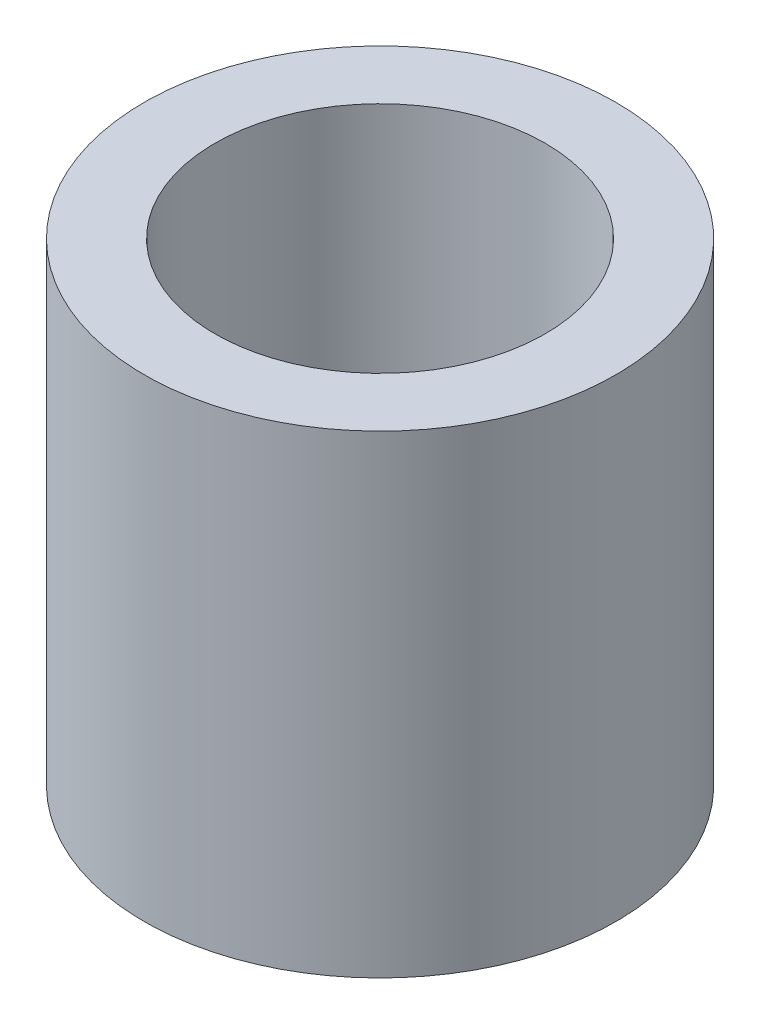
SolidWorks part; units mm, degrees
ref_plane "Plan de face" through (0, 0, 0) normal (0, 0, 1) x (1, 0, 0)
ref_plane "Plan de dessus" through (0, 0, 0) normal (0, 1, 0) x (1, 0, 0)
ref_plane "Plan de droite" through (0, 0, 0) normal (1, 0, 0) x (0, 0, -1)
sketch "Esquisse1" plane through (0, 0, 0) normal (0, 0, 1) x (1, 0, 0)
  line L0 (0, 0) -> (0, 62.8412) construction
  line L1 (20, 0) -> (0, 0) construction
  line L2 (14, 0) -> (20, 0)
  line L3 (14, 0) -> (14, 40.15)
  line L4 (14, 40.15) -> (20, 40.15)
  line L5 (20, 0) -> (20, 40.15)
  dimension "D1" = 40.15
  dimension "D2" = 28
  dimension "D3" = 40
revolve "Révolution1" add sketch "Esquisse1" angle 360 about L0
